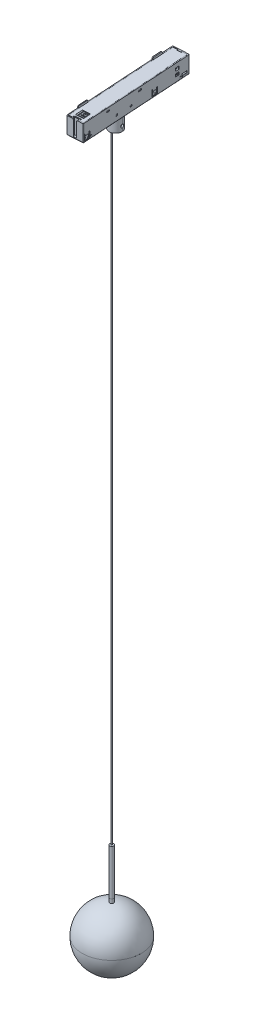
SolidWorks part; units mm, degrees
ref_plane "Alzado" through (0, 0, 0) normal (0, 0, 1) x (1, 0, 0)
ref_plane "Planta" through (0, 0, 0) normal (0, 1, 0) x (1, 0, 0)
ref_plane "Vista lateral" through (0, 0, 0) normal (1, 0, 0) x (0, 0, -1)
imported_body "MOON-1-solid1"
imported_body "MOON-1-solid2"
imported_body "TRACK_perfil-2-solid1"
imported_body "TRACK_perfil-2-solid2"
imported_body "TRACK_perfil-2-solid3"
imported_body "TRACK_perfil-2-solid4"
imported_body "TRACK_perfil-2-solid5"
imported_body "TRACK_perfil-2-solid6"
imported_body "TRACK_perfil-2-solid7"
imported_body "TRACK_perfil-2-solid8"
imported_body "TRACK_perfil-2-solid9"
imported_body "TRACK_perfil-2-solid10"
imported_body "TRACK_perfil-2-solid11"
imported_body "TRACK_perfil-2-solid12"
imported_body "TRACK_perfil-2-solid13"
imported_body "TRACK_perfil-2-solid14"
imported_body "TRACK_perfil-2-solid15"
imported_body "TRACK_perfil-2-solid16"
imported_body "TRACK_perfil-2-solid17"
imported_body "TRACK_perfil-2-solid18"
imported_body "TRACK_perfil-2-solid19"
imported_body "TRACK_perfil-2-solid20"
imported_body "TRACK_perfil-2-solid21"
imported_body "TRACK_perfil-2-solid22"
imported_body "TRACK_perfil-2-solid23"
imported_body "TRACK_perfil-2-solid24"
imported_body "TRACK_perfil-2-solid25"
imported_body "TRACK_perfil-2-solid26"
imported_body "TRACK_perfil-2-solid27"
imported_body "TRACK_perfil-2-surface1"
sketch "Croquis1" plane through (0, -545.8142, 0) normal (0, 1, 0) x (1, 0, 0)
  circle A0 centre (-126.5368, 123.3602) radius 2
extrude "Saliente-Extruir1" add sketch "Croquis1" against normal blind 4 separate body
sketch "Croquis2" plane through (0, -545.8142, 0) normal (0, 1, 0) x (1, 0, 0)
  circle A0 centre (-126.5368, 123.3602) radius 2
extrude "Saliente-Extruir2" add sketch "Croquis2" along normal blind 46
